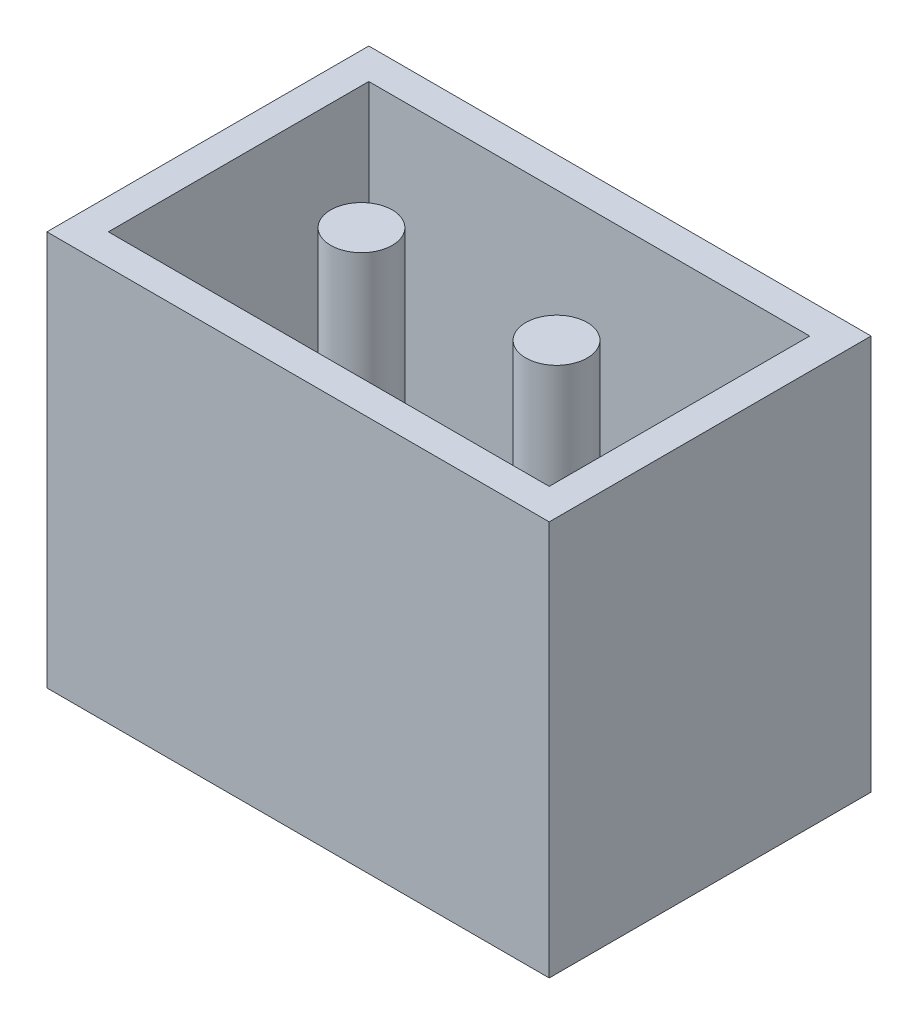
SolidWorks part; units mm, degrees
ref_plane "Front Plane" through (0, 0, 0) normal (0, 0, 1) x (1, 0, 0)
ref_plane "Top Plane" through (0, 0, 0) normal (0, 1, 0) x (1, 0, 0)
ref_plane "Right Plane" through (0, 0, 0) normal (1, 0, 0) x (0, 0, -1)
sketch "Sketch1" plane through (0, 0, 0) normal (0, 1, 0) x (1, 0, 0)
  line L1 (0, 0) -> (13.081, 0)
  line L2 (0, 0) -> (0, 8.382)
  line L3 (0, 8.382) -> (13.081, 8.382)
  line L4 (13.081, 0) -> (13.081, 8.382)
  dimension "D1" = 13.081
  dimension "D2" = 8.382
extrude "Extrude1" add sketch "Sketch1" along normal blind 10.287
sketch "Sketch2" plane through (0, 10.287, 0) normal (0, 1, 0) x (-1, 0, 0)
  line L0 (0, 0) -> (-13.081, 0) construction
  line L1 (-12.2809, -0.8001) -> (-0.8001, -0.8001)
  line L2 (-12.2809, -0.8001) -> (-12.2809, -7.5819)
  line L3 (-12.2809, -7.5819) -> (-0.8001, -7.5819)
  line L4 (-0.8001, -0.8001) -> (-0.8001, -7.5819)
  line L5 (-13.081, 0) -> (-13.081, -8.382) construction
  line L6 (-6.5405, -0.8001) -> (-6.5405, -7.5819) construction
  line L7 (-12.2809, -4.191) -> (-0.8001, -4.191) construction
  circle A0 centre (-9.0805, -4.191) radius 0.8001
  circle A1 centre (-4.0005, -4.191) radius 0.8001
  dimension "D5" = 1.6002
  dimension "D1" = 11.4808
  dimension "D2" = 6.7818
  dimension "D3" = 0.8001
  dimension "D4" = 0.8001
  dimension "D6" = 2.54
extrude "Cut-Extrude1" cut sketch "Sketch2" against normal blind 7.9375
sketch "Sketch3" plane through (0, 0, 0) normal (0, -1, 0) x (1, 0, 0)
  line L0 (6.5405, 0) -> (6.5405, -8.382) construction
  line L1 (0, 0) -> (13.081, 0) construction
  line L2 (13.081, -8.382) -> (0, -8.382) construction
  line L3 (13.081, -4.191) -> (0, -4.191) construction
  line L4 (13.081, 0) -> (13.081, -8.382) construction
  line L5 (0, -8.382) -> (0, 0) construction
  point P12 (9.0805, -4.191)
  dimension "D1" = 2.54
